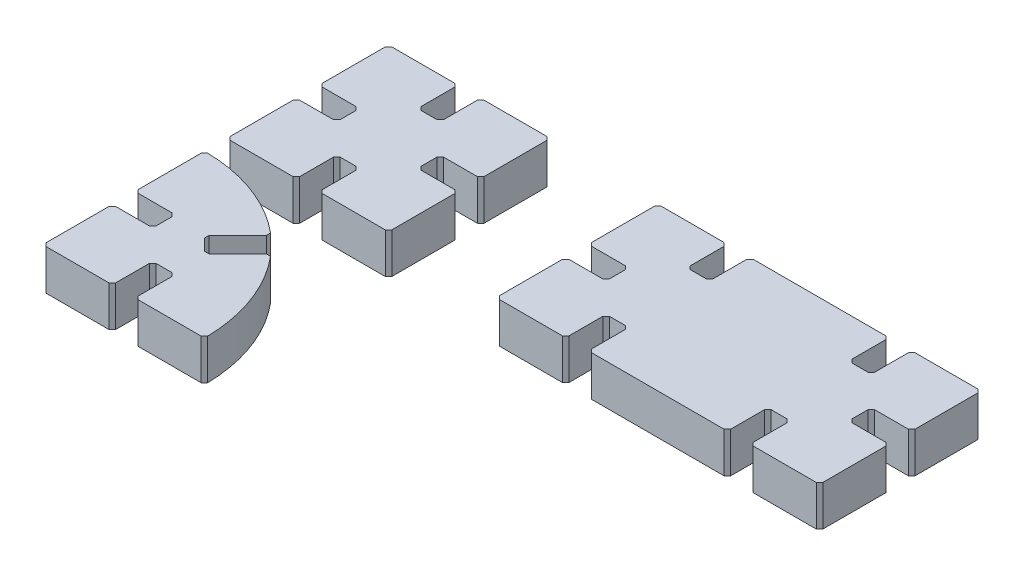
SolidWorks part; units mm, degrees
ref_plane "Front Plane" through (0, 0, 0) normal (0, 0, 1) x (1, 0, 0)
ref_plane "Top Plane" through (0, 0, 0) normal (0, 1, 0) x (1, 0, 0)
ref_plane "Right Plane" through (0, 0, 0) normal (1, 0, 0) x (0, 0, -1)
sketch "Sketch1" plane through (0, 0, 0) normal (0, 1, 0) x (1, 0, 0)
  line L0 (0, 25.4) -> (25.4, 0) construction
  line L1 (0.508, 0) -> (10.414, 0)
  line L2 (0, 0.508) -> (0, 10.414)
  line L3 (0.508, 25.4) -> (10.414, 25.4)
  line L4 (25.4, 0.508) -> (25.4, 10.414)
  line L5 (0, 0) -> (25.4, 25.4) construction
  line L6 (24.892, 14.478) -> (19.558, 14.478)
  line L8 (10.922, 24.892) -> (10.922, 19.558)
  line L9 (11.43, 19.05) -> (13.97, 19.05)
  line L10 (14.478, 24.892) -> (14.478, 19.558)
  line L11 (19.05, 13.97) -> (19.05, 11.43)
  line L12 (24.892, 10.922) -> (19.558, 10.922)
  line L13 (25.4, 25.4) -> (0, 0) construction
  line L14 (14.478, 0.508) -> (14.478, 5.842)
  line L15 (13.97, 6.35) -> (11.43, 6.35)
  line L16 (10.922, 0.508) -> (10.922, 5.842)
  line L17 (25.4, 0) -> (0, 25.4) construction
  line L18 (0.508, 10.922) -> (5.842, 10.922)
  line L19 (6.35, 11.43) -> (6.35, 13.97)
  line L20 (0.508, 14.478) -> (5.842, 14.478)
  line L21 (0, 0) -> (25.4, 25.4) construction
  line L22 (14.986, 25.4) -> (24.892, 25.4)
  line L23 (25.4, 14.986) -> (25.4, 24.892)
  line L24 (14.986, 0) -> (24.892, 0)
  line L25 (0, 14.986) -> (0, 24.892)
  line L26 (10.414, 25.4) -> (10.922, 24.892)
  line L27 (14.478, 24.892) -> (14.986, 25.4)
  line L28 (24.892, 25.4) -> (25.4, 24.892)
  line L29 (25.4, 14.986) -> (24.892, 14.478)
  line L30 (0, 24.892) -> (0.508, 25.4)
  line L31 (0, 14.986) -> (0.508, 14.478)
  line L32 (0, 10.414) -> (0.508, 10.922)
  line L33 (0, 0.508) -> (0.508, 0)
  line L34 (10.414, 0) -> (10.922, 0.508)
  line L35 (14.986, 0) -> (14.478, 0.508)
  line L36 (24.892, 0) -> (25.4, 0.508)
  line L37 (25.4, 10.414) -> (24.892, 10.922)
  line L38 (19.05, 11.43) -> (19.558, 10.922)
  line L39 (19.558, 14.478) -> (19.05, 13.97)
  line L40 (6.35, 13.97) -> (5.842, 14.478)
  line L41 (5.842, 10.922) -> (6.35, 11.43)
  line L42 (11.43, 6.35) -> (10.922, 5.842)
  line L43 (14.478, 5.842) -> (13.97, 6.35)
  line L44 (13.97, 19.05) -> (14.478, 19.558)
  line L45 (10.922, 19.558) -> (11.43, 19.05)
  line L46 (43.3206, -0.508) -> (53.2266, -0.508)
  line L48 (49.1626, 13.462) -> (48.6546, 13.97)
  line L49 (42.8126, -0.508) -> (68.2126, 24.892) construction
  line L51 (57.2906, 0) -> (57.2906, 5.334)
  line L52 (54.2426, 5.842) -> (53.7346, 5.334)
  line L53 (54.2426, 18.542) -> (56.7826, 18.542)
  line L54 (43.3206, 10.414) -> (48.6546, 10.414)
  line L55 (56.7826, 18.542) -> (57.2906, 19.05)
  line L57 (53.2266, -0.508) -> (53.7346, 0)
  line L58 (42.8126, 24.892) -> (68.2126, -0.508) construction
  line L59 (43.3206, 24.892) -> (53.2266, 24.892)
  line L60 (57.7986, -0.508) -> (67.7046, -0.508)
  line L61 (68.2126, -0.508) -> (42.8126, 24.892) construction
  line L64 (42.8126, 24.384) -> (43.3206, 24.892)
  line L65 (49.1626, 10.922) -> (49.1626, 13.462)
  line L68 (42.8126, 14.478) -> (42.8126, 24.384)
  line L69 (42.8126, 0) -> (43.3206, -0.508)
  line L71 (68.2126, 24.892) -> (42.8126, -0.508) construction
  line L72 (42.8126, 0) -> (42.8126, 9.906)
  line L73 (48.6546, 10.414) -> (49.1626, 10.922)
  line L74 (53.7346, 24.384) -> (53.7346, 19.05)
  line L75 (56.7826, 5.842) -> (54.2426, 5.842)
  line L76 (57.2906, 5.334) -> (56.7826, 5.842)
  line L78 (43.3206, 13.97) -> (48.6546, 13.97)
  line L79 (53.7346, 19.05) -> (54.2426, 18.542)
  line L80 (57.7986, 24.892) -> (67.7046, 24.892)
  line L82 (42.8126, -0.508) -> (68.2126, 24.892) construction
  line L83 (53.7346, 0) -> (53.7346, 5.334)
  line L84 (57.2906, 24.384) -> (57.7986, 24.892)
  line L85 (57.7986, -0.508) -> (57.2906, 0)
  line L86 (57.2906, 24.384) -> (57.2906, 19.05)
  line L87 (53.2266, 24.892) -> (53.7346, 24.384)
  line L88 (42.8126, 14.478) -> (43.3206, 13.97)
  line L89 (42.8126, 9.906) -> (43.3206, 10.414)
  line L91 (68.7206, 24.892) -> (78.6266, 24.892)
  line L93 (82.6906, 24.384) -> (82.6906, 19.05)
  line L94 (82.1826, 18.542) -> (82.6906, 19.05)
  line L95 (82.1826, 5.842) -> (79.6426, 5.842)
  line L96 (82.6906, 24.384) -> (83.1986, 24.892)
  line L97 (87.7706, 13.97) -> (87.2626, 13.462)
  line L98 (87.2626, 13.462) -> (87.2626, 10.922)
  line L100 (79.1346, 0) -> (79.1346, 5.334)
  line L101 (93.1046, -0.508) -> (93.6126, 0)
  line L102 (79.1346, 24.384) -> (79.1346, 19.05)
  line L103 (83.1986, 24.892) -> (93.1046, 24.892)
  line L104 (68.2126, -0.508) -> (93.6126, 24.892) construction
  line L105 (82.6906, 0) -> (82.6906, 5.334)
  line L106 (93.6126, 24.892) -> (68.2126, -0.508) construction
  line L108 (93.6126, 0) -> (93.6126, 9.906)
  line L109 (68.7206, -0.508) -> (78.6266, -0.508)
  line L110 (93.6126, 14.478) -> (93.1046, 13.97)
  line L111 (83.1986, -0.508) -> (82.6906, 0)
  line L112 (79.6426, 18.542) -> (82.1826, 18.542)
  line L113 (78.6266, -0.508) -> (79.1346, 0)
  line L114 (68.2126, -0.508) -> (93.6126, 24.892) construction
  line L115 (93.6126, 14.478) -> (93.6126, 24.384)
  line L119 (82.6906, 5.334) -> (82.1826, 5.842)
  line L120 (78.6266, 24.892) -> (79.1346, 24.384)
  line L123 (79.1346, 19.05) -> (79.6426, 18.542)
  line L124 (93.6126, 9.906) -> (93.1046, 10.414)
  line L125 (93.6126, -0.508) -> (68.2126, 24.892) construction
  line L126 (93.1046, 24.892) -> (93.6126, 24.384)
  line L127 (87.2626, 10.922) -> (87.7706, 10.414)
  line L128 (68.2126, 24.892) -> (93.6126, -0.508) construction
  line L129 (79.6426, 5.842) -> (79.1346, 5.334)
  line L130 (83.1986, -0.508) -> (93.1046, -0.508)
  line L131 (93.1046, 13.97) -> (87.7706, 13.97)
  line L134 (93.1046, 10.414) -> (87.7706, 10.414)
  line L136 (67.7046, -0.508) -> (68.7206, -0.508)
  line L137 (68.7206, 24.892) -> (67.7046, 24.892)
  line L147 (14.478, -28.4052) -> (14.478, -23.0712)
  line L172 (25.4, -13.9272) -> (25.4, -4.0212)
  line L182 (10.922, -28.4052) -> (10.922, -23.0712)
  line L184 (0, -28.4052) -> (0.508, -28.9132)
  line L188 (25.4, -18.4992) -> (24.892, -17.9912)
  line L189 (0.508, -28.9132) -> (10.414, -28.9132)
  line L190 (0.508, -17.9912) -> (5.842, -17.9912)
  line L193 (5.842, -17.9912) -> (6.35, -17.4832)
  line L194 (14.986, -28.9132) -> (24.892, -28.9132)
  line L195 (14.478, -23.0712) -> (13.97, -22.5632)
  line L196 (0, -28.4052) -> (0, -18.4992)
  line L197 (0.508, -14.4352) -> (5.842, -14.4352)
  line L198 (24.892, -28.9132) -> (25.4, -28.4052)
  line L200 (6.35, -17.4832) -> (6.35, -14.9432)
  line L201 (24.892, -3.5132) -> (25.4, -4.0212)
  line L203 (0, -13.9272) -> (0.508, -14.4352)
  line L204 (0, -18.4992) -> (0.508, -17.9912)
  line L205 (25.4, -3.5132) -> (0, -28.9132) construction
  line L206 (10.414, -3.5132) -> (10.922, -4.0212)
  line L207 (14.478, -4.0212) -> (14.986, -3.5132)
  line L208 (14.986, -28.9132) -> (14.478, -28.4052)
  line L209 (0, -3.5132) -> (25.4, -28.9132) construction
  line L210 (0, -28.9132) -> (25.4, -3.5132) construction
  line L211 (14.986, -3.5132) -> (24.892, -3.5132)
  line L213 (0, -28.9132) -> (25.4, -3.5132) construction
  line L214 (25.4, -3.5132) -> (10.414, -3.5132)
  line L215 (0, -13.9272) -> (0, -28.9132)
  line L216 (6.35, -14.9432) -> (5.842, -14.4352)
  line L217 (10.414, -28.9132) -> (10.922, -28.4052)
  line L218 (11.43, -22.5632) -> (10.922, -23.0712)
  line L221 (25.4, -28.9132) -> (0, -3.5132) construction
  line L222 (25.4, -28.4052) -> (25.4, -18.4992)
  line L224 (13.97, -22.5632) -> (11.43, -22.5632)
  line L225 (25.4, -13.9272) -> (24.892, -14.4352)
  line L226 (0, -13.9272) -> (0, -3.5132)
  line L227 (0, -3.5132) -> (25.4, -3.5132) construction
  line L228 (0, -3.5132) -> (0, -28.9132) construction
  line L229 (0, -28.9132) -> (25.4, -28.9132) construction
  line L230 (25.4, -3.5132) -> (25.4, -28.9132) construction
  line L231 (0, -3.5132) -> (25.4, -28.9132) construction
  line L232 (0, -28.9132) -> (25.4, -3.5132) construction
  line L233 (0, -4.0212) -> (0.508, -3.5132)
  line L234 (16.6592, -9.7395) -> (11.4428, -14.956)
  line L235 (11.4428, -14.956) -> (13.9572, -17.4705)
  line L236 (19.1737, -12.254) -> (13.9572, -17.4705)
  arc A0 (25.4, -28.9132) -> (19.1737, -12.254) centre (0, -28.9132) ccw
  arc A1 (16.6592, -9.7395) -> (0, -3.5132) centre (0, -28.9132) ccw
  point P4 (12.7, 12.7)
  point P5 (10.922, 25.4)
  point P7 (14.478, 19.05)
  point P8 (10.922, 19.05)
  point P9 (14.478, 25.4)
  point P15 (25.4, 14.478)
  point P16 (19.05, 10.922)
  point P17 (19.05, 14.478)
  point P18 (25.4, 10.922)
  point P21 (14.478, 0)
  point P22 (10.922, 6.35)
  point P23 (14.478, 6.35)
  point P24 (10.922, 0)
  point P27 (0, 10.922)
  point P28 (6.35, 14.478)
  point P29 (6.35, 10.922)
  point P30 (0, 14.478)
  point P31 (12.7, 12.7)
  point P73 (53.7346, 24.892)
  point P74 (57.2906, 18.542)
  point P75 (53.7346, 18.542)
  point P76 (57.2906, 24.892)
  point P87 (57.2906, -0.508)
  point P88 (53.7346, 5.842)
  point P89 (57.2906, 5.842)
  point P90 (53.7346, -0.508)
  point P93 (42.8126, 10.414)
  point P94 (49.1626, 13.97)
  point P95 (49.1626, 10.414)
  point P96 (42.8126, 13.97)
  point P97 (55.5126, 12.192)
  point P101 (10.922, -3.5132)
  point P117 (14.478, -3.5132)
  point P122 (25.4, -14.4352)
  point P140 (79.1346, 24.892)
  point P141 (82.6906, 18.542)
  point P142 (79.1346, 18.542)
  point P143 (82.6906, 24.892)
  point P148 (93.6126, 13.97)
  point P149 (87.2626, 10.414)
  point P150 (87.2626, 13.97)
  point P151 (93.6126, 10.414)
  point P154 (82.6906, -0.508)
  point P155 (79.1346, 5.842)
  point P156 (82.6906, 5.842)
  point P157 (79.1346, -0.508)
  point P161 (25.4, -17.9912)
  point P164 (80.9126, 12.192)
  point P171 (14.478, -28.9132)
  point P173 (10.922, -22.5632)
  point P174 (14.478, -22.5632)
  point P175 (10.922, -28.9132)
  point P191 (0, -17.9912)
  point P192 (6.35, -14.4352)
  point P193 (6.35, -17.9912)
  point P194 (0, -14.4352)
  point P203 (12.7, -16.2132)
  point P243 (12.7, -16.2132)
  dimension "D1" = 25.4
  dimension "D3" = 3.556
  dimension "D4" = 6.35
  dimension "D5" = 1.778
  dimension "D7" = 25.4
  dimension "D8" = 3.556
  dimension "D29" = 6.35
  dimension "D30" = 0.508
  dimension "D31" = 0.508
  dimension "D32" = 0.508
  dimension "D33" = 0.508
  dimension "D34" = 0.508
  dimension "D35" = 0.508
  dimension "D36" = 0.508
  dimension "D37" = 0.508
  dimension "D38" = 0.508
  dimension "D39" = 0.508
  dimension "D40" = 0.508
  dimension "D41" = 0.508
  dimension "D42" = 0.508
  dimension "D43" = 0.508
  dimension "D44" = 0.508
  dimension "D45" = 0.508
  dimension "D46" = 0.508
  dimension "D47" = 0.508
  dimension "D48" = 0.508
  dimension "D49" = 0.508
  dimension "D50" = 0.508
  dimension "D51" = 0.508
  dimension "D52" = 0.508
  dimension "D53" = 0.508
  dimension "D54" = 0.508
  dimension "D55" = 0.508
  dimension "D56" = 25.4
  dimension "D58" = 0.508
  dimension "D59" = 0.508
  dimension "D60" = 0.508
  dimension "D61" = 0.508
  dimension "D62" = 0.508
  dimension "D63" = 0.508
  dimension "D64" = 0.508
  dimension "D65" = 0.508
  dimension "D66" = 0.508
  dimension "D67" = 0.508
  dimension "D68" = 0.508
  dimension "D69" = 0.508
  dimension "D70" = 0.508
  dimension "D71" = 25.4
  dimension "D72" = 3.556
  dimension "D73" = 6.35
  dimension "D74" = 0.508
  dimension "D75" = 0.508
  dimension "D76" = 0.508
  dimension "D77" = 0.508
  dimension "D78" = 0.508
  dimension "D79" = 0.508
  dimension "D80" = 0.508
  dimension "D81" = 0.508
  dimension "D82" = 0.508
  dimension "D83" = 0.508
  dimension "D84" = 0.508
  dimension "D85" = 0.508
  dimension "D86" = 0.508
  dimension "D87" = 0.508
  dimension "D88" = 0.508
  dimension "D89" = 0.508
  dimension "D90" = 0.508
  dimension "D91" = 0.508
  dimension "D92" = 0.508
  dimension "D93" = 0.508
  dimension "D94" = 0.508
  dimension "D95" = 0.508
  dimension "D96" = 0.508
  dimension "D97" = 0.508
  dimension "D98" = 0.508
  dimension "D99" = 0.508
  dimension "D100" = 0.508
  dimension "D101" = 0.508
  dimension "D102" = 0.508
  dimension "D103" = 0.508
  dimension "D104" = 0.508
  dimension "D105" = 0.508
  dimension "D106" = 0.508
  dimension "D107" = 0.508
  dimension "D108" = 0.508
  dimension "D109" = 0.508
  dimension "D110" = 0.508
  dimension "D111" = 0.508
  dimension "D112" = 0.508
  dimension "D113" = 0.508
  dimension "D114" = 0.508
  dimension "D115" = 0.508
  dimension "D116" = 0.508
  dimension "D117" = 0.508
  dimension "D118" = 0.508
  dimension "D121" = 0.508
  dimension "D122" = 0.508
  dimension "D123" = 0.508
  dimension "D124" = 0.508
  dimension "D125" = 0.508
  dimension "D126" = 0.508
  dimension "D127" = 0.508
  dimension "D128" = 0.508
  dimension "D6" = 4
extrude "Boss-Extrude2" add sketch "Sketch1" along normal blind 6.35 contours L234 A1 L233 L226 L203 L197 L216 L200 L193 L190 L204 L196 L184 L189 L217 L182 L218 L224 L195 L147 L208 L194 L198 A0 L236 L235 | L45 L8 L26 L3 L30 L25 L31 L20 L40 L19 L41 L18 L32 L2 L33 L1 L34 L16 L42 L15 L43 L14 L35 L24 L36 L4 L37 L12 L38 L11 L39 L6 L29 L23 L28 L22 L27 L10 L44 L9 | L91 L137 L80 L84 L86 L55 L53 L79 L74 L87 L59 L64 L68 L88 L78 L48 L65 L73 L54 L89 L72 L69 L46 L57 L83 L52 L75 L76 L51 L85 L60 L136 L109 L113 L100 L129 L95 L119 L105 L111 L130 L101 L108 L124 L134 L127 L98 L97 L131 L110 L115
chamfer "Chamfer1" distance 0.508 angle 45 4 edges at (19.1737, 3.175, 12.254) (13.9572, 3.175, 17.4705) (11.4428, 3.175, 14.956) (16.6592, 3.175, 9.7395)
